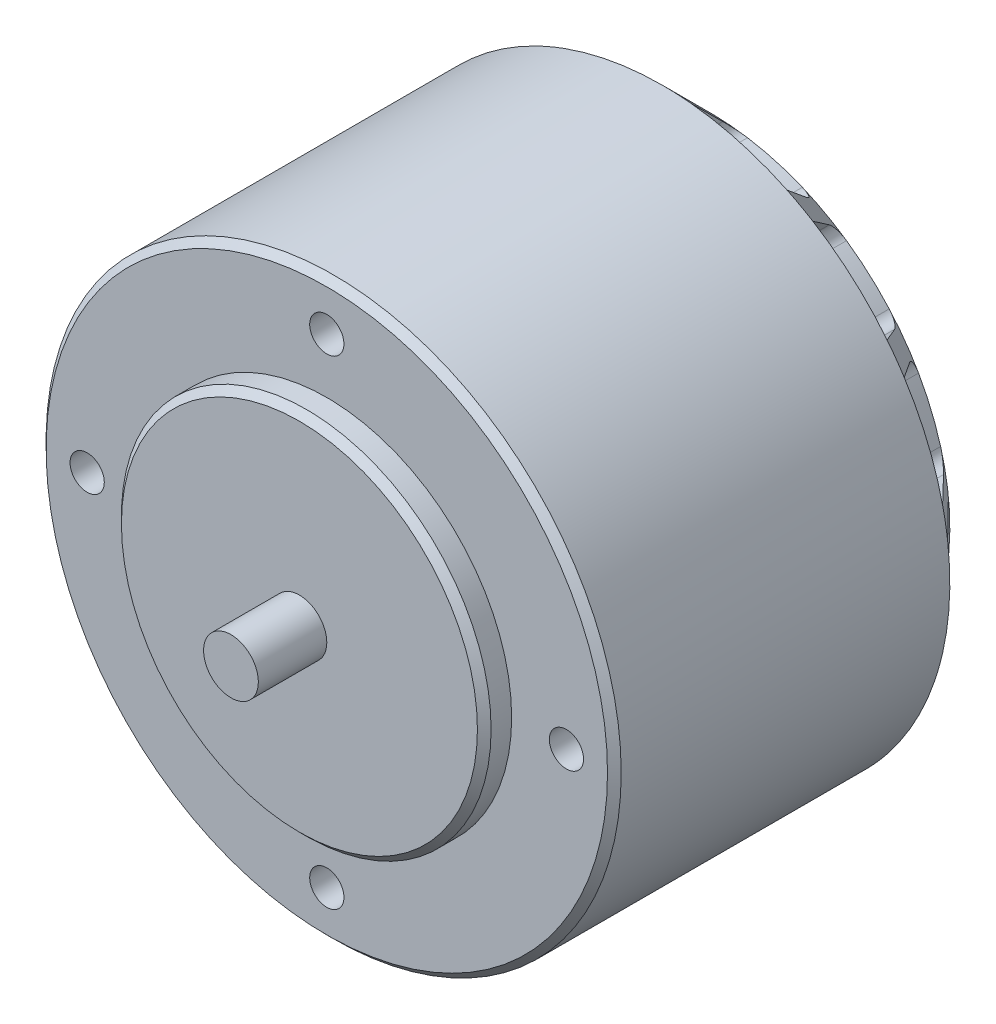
SolidWorks part; units mm, degrees
ref_plane "前视基准面" through (0, 0, 0) normal (0, 0, 1) x (1, 0, 0)
ref_plane "上视基准面" through (0, 0, 0) normal (0, 1, 0) x (1, 0, 0)
ref_plane "右视基准面" through (0, 0, 0) normal (1, 0, 0) x (0, 0, -1)
sketch "Sketch1" plane through (0, 0, 0) normal (0, 0, 1) x (1, 0, 0)
  circle A0 centre (0, 0) radius 21
  dimension "D1" = 42
extrude "Boss-Extrude1" add sketch "Sketch1" along normal blind 30
chamfer "Chamfer1" distance 3.5 angle 45 1 edges at (21, 0, 0)
sketch "Sketch2" plane through (0, 0, 0) normal (0, 0, -1) x (-1, 0, 0)
  line L0 (0, 18.473) -> (0, 21)
  line L1 (6.2742, 17.3748) -> (7.1325, 19.7516)
  line L2 (8.0151, 16.6436) -> (9.1116, 18.9203)
  line L3 (13.1915, 12.9319) -> (14.9961, 14.7009)
  line L4 (14.4427, 11.5177) -> (16.4185, 13.0933)
  line L5 (17.4961, 5.9276) -> (19.8895, 6.7385)
  line L6 (18.0098, 4.1106) -> (20.4735, 4.6729)
  line L7 (18.3353, -2.2507) -> (20.8436, -2.5586)
  line L8 (18.0098, -4.1106) -> (20.4735, -4.6729)
  line L9 (15.543, -9.9832) -> (17.6693, -11.3489)
  line L10 (14.4427, -11.5177) -> (16.4185, -13.0933)
  line L11 (9.6722, -15.7384) -> (10.9954, -17.8914)
  line L12 (8.0151, -16.6436) -> (9.1116, -18.9203)
  line L13 (1.8858, -18.3765) -> (2.1437, -20.8903)
  line L14 (0, -18.473) -> (0, -21)
  line L15 (-6.2742, -17.3748) -> (-7.1325, -19.7516)
  line L16 (-8.0151, -16.6436) -> (-9.1116, -18.9203)
  line L17 (-13.1915, -12.9319) -> (-14.9961, -14.7009)
  line L18 (-14.4427, -11.5177) -> (-16.4185, -13.0933)
  line L19 (-17.4961, -5.9276) -> (-19.8895, -6.7385)
  line L20 (-18.0098, -4.1106) -> (-20.4735, -4.6729)
  line L21 (-18.3353, 2.2507) -> (-20.8436, 2.5586)
  line L22 (-18.0098, 4.1106) -> (-20.4735, 4.6729)
  line L23 (-15.543, 9.9832) -> (-17.6693, 11.3489)
  line L24 (-14.4427, 11.5177) -> (-16.4185, 13.0933)
  line L25 (-9.6722, 15.7384) -> (-10.9954, 17.8914)
  line L26 (-8.0151, 16.6436) -> (-9.1116, 18.9203)
  line L27 (-1.8858, 18.3765) -> (-2.1437, 20.8903)
  arc A0 (7.1325, 19.7516) -> (0, 21) centre (0, 0) ccw
  arc A1 (5.0454, 16.7569) -> (0.9459, 17.4744) centre (0, 0) ccw
  arc A2 (0.9459, 17.4744) -> (0, 18.473) centre (1, 18.473) cw
  arc A3 (5.0454, 16.7569) -> (6.2742, 17.3748) centre (5.3337, 17.7145) ccw
  arc A4 (14.9961, 14.7009) -> (9.1116, 18.9203) centre (0, 0) ccw
  arc A5 (11.8163, 12.9084) -> (8.4341, 15.3335) centre (0, 0) ccw
  arc A6 (8.4341, 15.3335) -> (8.0151, 16.6436) centre (8.9161, 16.2097) cw
  arc A7 (11.8163, 12.9084) -> (13.1915, 12.9319) centre (12.4915, 13.646) ccw
  arc A8 (19.8895, 6.7385) -> (16.4185, 13.0933) centre (0, 0) ccw
  arc A9 (16.2468, 6.5031) -> (14.2518, 10.1555) centre (0, 0) ccw
  arc A10 (14.2518, 10.1555) -> (14.4427, 11.5177) centre (15.0662, 10.7359) cw
  arc A11 (16.2468, 6.5031) -> (17.4961, 5.9276) centre (17.1752, 6.8747) ccw
  arc A12 (20.8436, -2.5586) -> (20.4735, 4.6729) centre (0, 0) ccw
  arc A13 (17.4595, -1.1901) -> (17.2468, 2.9662) centre (0, 0) ccw
  arc A14 (17.2468, 2.9662) -> (18.0098, 4.1106) centre (18.2323, 3.1357) cw
  arc A15 (17.4595, -1.1901) -> (18.3353, -2.2507) centre (18.4572, -1.2581) ccw
  arc A16 (17.6693, -11.3489) -> (20.4735, -4.6729) centre (0, 0) ccw
  arc A17 (15.2141, -8.6476) -> (16.8258, -4.8107) centre (0, 0) ccw
  arc A18 (16.8258, -4.8107) -> (18.0098, -4.1106) centre (17.7873, -5.0855) cw
  arc A19 (15.2141, -8.6476) -> (15.543, -9.9832) centre (16.0835, -9.1418) ccw
  arc A20 (10.9954, -17.8914) -> (16.4185, -13.0933) centre (0, 0) ccw
  arc A21 (9.9553, -14.3924) -> (13.0723, -11.6347) centre (0, 0) ccw
  arc A22 (13.0723, -11.6347) -> (14.4427, -11.5177) centre (13.8192, -12.2995) cw
  arc A23 (9.9553, -14.3924) -> (9.6722, -15.7384) centre (10.5242, -15.2148) ccw
  arc A24 (2.1437, -20.8903) -> (9.1116, -18.9203) centre (0, 0) ccw
  arc A25 (2.7248, -17.2866) -> (6.7296, -16.1543) centre (0, 0) ccw
  arc A26 (6.7296, -16.1543) -> (8.0151, -16.6436) centre (7.1141, -17.0774) cw
  arc A27 (2.7248, -17.2866) -> (1.8858, -18.3765) centre (2.8805, -18.2744) ccw
  arc A28 (-7.1325, -19.7516) -> (0, -21) centre (0, 0) ccw
  arc A29 (-5.0454, -16.7569) -> (-0.9459, -17.4744) centre (0, 0) ccw
  arc A30 (-0.9459, -17.4744) -> (0, -18.473) centre (-1, -18.473) cw
  arc A31 (-5.0454, -16.7569) -> (-6.2742, -17.3748) centre (-5.3337, -17.7145) ccw
  arc A32 (-14.9961, -14.7009) -> (-9.1116, -18.9203) centre (0, 0) ccw
  arc A33 (-11.8163, -12.9084) -> (-8.4341, -15.3335) centre (0, 0) ccw
  arc A34 (-8.4341, -15.3335) -> (-8.0151, -16.6436) centre (-8.9161, -16.2097) cw
  arc A35 (-11.8163, -12.9084) -> (-13.1915, -12.9319) centre (-12.4915, -13.646) ccw
  arc A36 (-19.8895, -6.7385) -> (-16.4185, -13.0933) centre (0, 0) ccw
  arc A37 (-16.2468, -6.5031) -> (-14.2518, -10.1555) centre (0, 0) ccw
  arc A38 (-14.2518, -10.1555) -> (-14.4427, -11.5177) centre (-15.0662, -10.7359) cw
  arc A39 (-16.2468, -6.5031) -> (-17.4961, -5.9276) centre (-17.1752, -6.8747) ccw
  arc A40 (-20.8436, 2.5586) -> (-20.4735, -4.6729) centre (0, 0) ccw
  arc A41 (-17.4595, 1.1901) -> (-17.2468, -2.9662) centre (0, 0) ccw
  arc A42 (-17.2468, -2.9662) -> (-18.0098, -4.1106) centre (-18.2323, -3.1357) cw
  arc A43 (-17.4595, 1.1901) -> (-18.3353, 2.2507) centre (-18.4572, 1.2581) ccw
  arc A44 (-17.6693, 11.3489) -> (-20.4735, 4.6729) centre (0, 0) ccw
  arc A45 (-15.2141, 8.6476) -> (-16.8258, 4.8107) centre (0, 0) ccw
  arc A46 (-16.8258, 4.8107) -> (-18.0098, 4.1106) centre (-17.7873, 5.0855) cw
  arc A47 (-15.2141, 8.6476) -> (-15.543, 9.9832) centre (-16.0835, 9.1418) ccw
  arc A48 (-10.9954, 17.8914) -> (-16.4185, 13.0933) centre (0, 0) ccw
  arc A49 (-9.9553, 14.3924) -> (-13.0723, 11.6347) centre (0, 0) ccw
  arc A50 (-13.0723, 11.6347) -> (-14.4427, 11.5177) centre (-13.8192, 12.2995) cw
  arc A51 (-9.9553, 14.3924) -> (-9.6722, 15.7384) centre (-10.5242, 15.2148) ccw
  arc A52 (-2.1437, 20.8903) -> (-9.1116, 18.9203) centre (0, 0) ccw
  arc A53 (-2.7248, 17.2866) -> (-6.7296, 16.1543) centre (0, 0) ccw
  arc A54 (-6.7296, 16.1543) -> (-8.0151, 16.6436) centre (-7.1141, 17.0774) cw
  arc A55 (-2.7248, 17.2866) -> (-1.8858, 18.3765) centre (-2.8805, 18.2744) ccw
  point P117 (0, 0)
  dimension "D1" = 42
  dimension "D2" = 1
  dimension "D3" = 14
extrude "Cut-Extrude1" cut sketch "Sketch2" against normal blind 3.5
sketch "Sketch3" plane through (0, 0, 0) normal (0, 0, -1) x (-1, 0, 0)
  circle A0 centre (0, 0) radius 3
  dimension "D1" = 6
extrude "Boss-Extrude2" add sketch "Sketch3" along normal blind 4
sketch "Sketch4" plane through (0, 0, 0) normal (0, 0, -1) x (-1, 0, 0)
  circle A0 centre (6, 0) radius 1.25
  circle A1 centre (0, 0) radius 3 construction
  circle A2 centre (-6, 0) radius 1.25
  point P8 (0, 0)
  dimension "D1" = 6
  dimension "D2" = 2.5
  dimension "D3" = 2
extrude "Cut-Extrude2" cut sketch "Sketch4" against normal blind 4
sketch "Sketch5" plane through (0, 0, 30) normal (0, 0, 1) x (1, 0, 0)
  circle A0 centre (0, 0) radius 13.5
  dimension "D1" = 27
extrude "Cut-Extrude3" cut sketch "Sketch5" against normal blind 2 flip side to cut
chamfer "Chamfer2" distance 0.5 angle 45 2 edges at (21, 0, 28) (13.5, 0, 30)
sketch "Sketch6" plane through (0, 0, 28) normal (0, 0, 1) x (1, 0, 0)
  circle A0 centre (17.5, 0) radius 1.25
  circle A1 centre (0, -17.5) radius 1.25
  circle A2 centre (-17.5, 0) radius 1.25
  circle A3 centre (0, 17.5) radius 1.25
  point P11 (0, 0)
  dimension "D1" = 2.5
  dimension "D3" = 17.5
  dimension "D2" = 4
extrude "Cut-Extrude4" cut sketch "Sketch6" against normal blind 4
sketch "Sketch7" plane through (0, 0, 30) normal (0, 0, 1) x (1, 0, 0)
  circle A0 centre (0, 0) radius 2
  dimension "D1" = 4
extrude "Boss-Extrude3" add sketch "Sketch7" along normal blind 5
hole_wizard "M3 Tapped Hole2" positions "3DSketch3" profile "Sketch11" tap size "M3" standard "GB"
sketch3d "3DSketch3"
  line L0 (-17.5, 0, 24) -> (-17.5, 0, 28) construction
  line L1 (0, 17.5, 24) -> (0, 17.5, 28) construction
  line L2 (17.5, 0, 24) -> (17.5, 0, 28) construction
  line L3 (0, -17.5, 24) -> (0, -17.5, 28) construction
  point P0 (-17.5, 0, 28)
  point P4 (0, 17.5, 28)
  point P8 (17.5, 0, 28)
  point P12 (0, -17.5, 28)
sketch "Sketch11" plane through (-17.5, 0, 28) normal (1, 0, 0) x (0, -1, 0)
  line L0 (0, 0) -> (0, 8.2511)
  line L1 (0, 8.2511) -> (1.25, 7.5)
  line L2 (1.25, 7.5) -> (1.25, 0)
  line L5 (1.25, 0) -> (0, 0)
  line L10 (0, 8.2511) -> (-1.25, 7.5) construction
  line L11 (0, -6.35) -> (0, 107.95) construction
  dimension "Tap Drill Dia." = 2.5
  dimension "Tap Drill Depth" = 7.5
  dimension "Drill Angle" = 118
hole_wizard "M3 Tapped Hole3" positions "3DSketch4" profile "Sketch12" tap size "M3" standard "GB"
sketch3d "3DSketch4"
  line L0 (-6, 0, 4) -> (-6, 0, 0) construction
  line L1 (6, 0, 4) -> (6, 0, 0) construction
  point P0 (-6, 0, 0)
  point P4 (6, 0, 0)
sketch "Sketch12" plane through (-6, 0, 0) normal (1, 0, 0) x (0, 1, 0)
  line L0 (0, 0) -> (0, 8.2511)
  line L1 (0, 8.2511) -> (1.25, 7.5)
  line L2 (1.25, 7.5) -> (1.25, 0)
  line L5 (1.25, 0) -> (0, 0)
  line L10 (0, 8.2511) -> (-1.25, 7.5) construction
  line L11 (0, -6.35) -> (0, 107.95) construction
  dimension "Tap Drill Dia." = 2.5
  dimension "Tap Drill Depth" = 7.5
  dimension "Drill Angle" = 118
